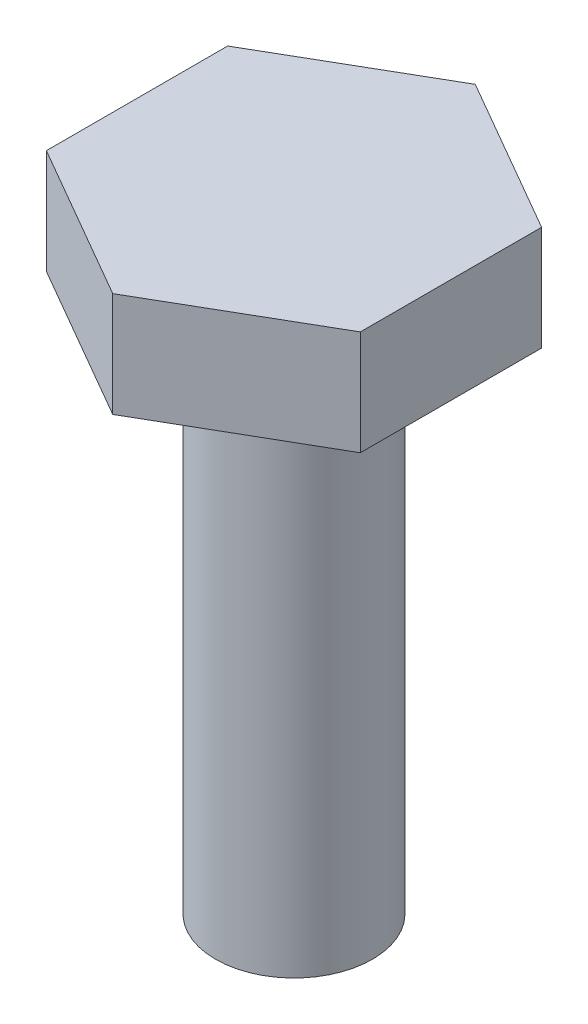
SolidWorks part; units mm, degrees
ref_plane "正面" through (0, 0, 0) normal (0, 0, 1) x (1, 0, 0)
ref_plane "平面" through (0, 0, 0) normal (0, 1, 0) x (1, 0, 0)
ref_plane "右側面" through (0, 0, 0) normal (1, 0, 0) x (0, 0, -1)
sketch "ｽｹｯﾁ1" plane through (0, 0, 0) normal (0, 1, 0) x (1, 0, 0)
  line L1 (0, 6.9282) -> (-6, 3.4641)
  line L2 (-6, 3.4641) -> (-6, -3.4641)
  line L3 (-6, -3.4641) -> (0, -6.9282)
  line L4 (0, -6.9282) -> (6, -3.4641)
  line L5 (6, -3.4641) -> (6, 3.4641)
  line L6 (6, 3.4641) -> (0, 6.9282)
  circle A0 centre (0, 0) radius 6 construction
  dimension "D1" = 12
extrude "押し出し1" add sketch "ｽｹｯﾁ1" along normal blind 4
sketch "ｽｹｯﾁ2" plane through (0, 0, 0) normal (0, 1, 0) x (1, 0, 0)
  circle A0 centre (0, 0) radius 3
  dimension "D1" = 6
extrude "押し出し2" add sketch "ｽｹｯﾁ2" against normal blind 20
